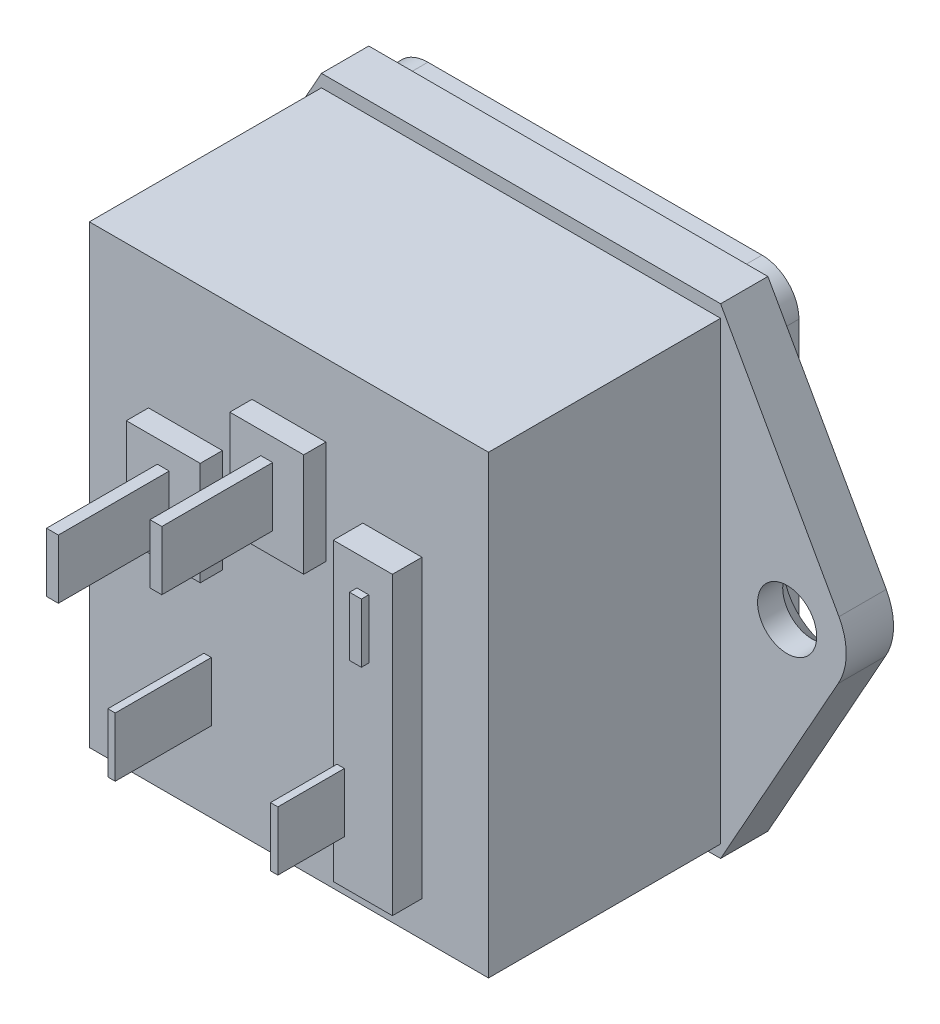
SolidWorks part; units mm, degrees
ref_plane "Front" through (0, 0, 0) normal (0, 0, 1) x (1, 0, 0)
ref_plane "Top" through (0, 0, 0) normal (0, 1, 0) x (1, 0, 0)
ref_plane "Right" through (0, 0, 0) normal (1, 0, 0) x (0, 0, -1)
sketch "Sketch1" plane through (0, 0, 0) normal (0, 0, 1) x (1, 0, 0)
  line L1 (-13.5, 15.4) -> (13.5, 15.4)
  line L2 (-13.5, 15.4) -> (-13.5, -15.4)
  line L3 (-13.5, -15.4) -> (13.5, -15.4)
  line L4 (13.5, 15.4) -> (13.5, -15.4)
extrude "Boss-Extrude1" add sketch "Sketch1" along normal blind 15.7
sketch "Sketch2" plane through (0, 0, 0) normal (0, 0, -1) x (-1, 0, 0)
  line L0 (13.5, 16.25) -> (-13.5, 16.25)
  line L1 (-13.5, -16.25) -> (13.5, -16.25)
  line L2 (-13.5, -16.25) -> (-21.4467, -2.0299)
  line L3 (-13.5, 16.25) -> (-21.5081, 1.9218)
  line L4 (13.5, 16.25) -> (21.5081, 1.9218)
  line L5 (13.5, -16.25) -> (21.5215, -1.8972)
  arc A0 (-21.5081, 1.9218) -> (-21.4467, -2.0299) centre (-18, 0) ccw
  arc A1 (21.5215, -1.8972) -> (21.5081, 1.9218) centre (18, 0) ccw
extrude "Boss-Extrude2" add sketch "Sketch2" along normal blind 3.2
sketch "Sketch3" plane through (0, 0, -3.2) normal (0, 0, -1) x (-1, 0, 0)
  line L0 (-13.8, -13) -> (-13.8, 13)
  line L1 (-11.3, 15.5) -> (11.3, 15.5)
  line L2 (13.8, 13) -> (13.8, -13)
  line L3 (11.3, -15.5) -> (-11.3, -15.5)
  arc A0 (13.8, 13) -> (11.3, 15.5) centre (11.3, 13) ccw
  arc A1 (-11.3, 15.5) -> (-13.8, 13) centre (-11.3, 13) ccw
  arc A2 (13.8, -13) -> (11.3, -15.5) centre (11.3, -13) cw
  arc A3 (-11.3, -15.5) -> (-13.8, -13) centre (-11.3, -13) cw
extrude "Boss-Extrude3" add sketch "Sketch3" along normal blind 1.8
sketch "Sketch4" plane through (0, 0, -3.2) normal (0, 0, -1) x (-1, 0, 0)
  circle A0 centre (-18.001, 0) radius 2
  circle A1 centre (18.001, 0) radius 2
extrude "Cut-Extrude1" cut sketch "Sketch4" against normal up to surface (3.2 mm away)
sketch "Sketch5" plane through (0, 0, -5) normal (0, 0, -1) x (-1, 0, 0)
  line L0 (-11, -2.1) -> (11, -2.1)
  line L1 (-7, 13.9) -> (7, 13.9)
  line L2 (12, -1.1) -> (12, 8.9)
  line L3 (-12, -1.1) -> (-12, 8.9)
  line L4 (12, 8.9) -> (7, 13.9)
  line L5 (-12, 8.9) -> (-7, 13.9)
  arc A0 (11, -2.1) -> (12, -1.1) centre (11, -1.1) ccw
  arc A1 (-11, -2.1) -> (-12, -1.1) centre (-11, -1.1) cw
extrude "Cut-Extrude2" cut sketch "Sketch5" against normal blind 19
sketch "Sketch6" plane through (0, 0, 14) normal (0, 0, -1) x (-1, 0, 0)
  line L1 (-1, 9) -> (1, 9)
  line L2 (-1, 9) -> (-1, 5)
  line L3 (-1, 5) -> (1, 5)
  line L4 (1, 9) -> (1, 5)
  line L5 (-8, 5) -> (-6, 5)
  line L6 (-8, 5) -> (-8, 1)
  line L7 (-8, 1) -> (-6, 1)
  line L8 (-6, 5) -> (-6, 1)
  line L9 (6, 1) -> (8, 1)
  line L10 (6, 1) -> (6, 5)
  line L11 (6, 5) -> (8, 5)
  line L12 (8, 1) -> (8, 5)
extrude "Boss-Extrude4" add sketch "Sketch6" along normal blind 17 separate body
sketch "Sketch7" plane through (0, 0, 15.7) normal (0, 0, 1) x (1, 0, 0)
  line L1 (-0.4, 9) -> (0.4, 9)
  line L2 (-0.4, 9) -> (-0.4, 5)
  line L3 (-0.4, 5) -> (0.4, 5)
  line L4 (0.4, 9) -> (0.4, 5)
  line L5 (-7.4, 5) -> (-6.6, 5)
  line L6 (-7.4, 5) -> (-7.4, 1)
  line L7 (-7.4, 1) -> (-6.6, 1)
  line L8 (-6.6, 5) -> (-6.6, 1)
extrude "Boss-Extrude5" add sketch "Sketch7" along normal blind 9 separate body
sketch "Sketch8" plane through (0, 0, 15.7) normal (0, 0, 1) x (1, 0, 0)
  line L1 (5, 7) -> (9, 7)
  line L2 (5, 7) -> (5, -13)
  line L3 (5, -13) -> (9, -13)
  line L4 (9, 7) -> (9, -13)
extrude "Boss-Extrude6" add sketch "Sketch8" along normal blind 2
sketch "Sketch9" plane through (0, 0, 17.7) normal (0, 0, 1) x (1, 0, 0)
  line L1 (6.6, 5) -> (7.4, 5)
  line L2 (6.6, 5) -> (6.6, 1)
  line L3 (6.6, 1) -> (7.4, 1)
  line L4 (7.4, 5) -> (7.4, 1)
extrude "Boss-Extrude7" add sketch "Sketch9" along normal blind 0.5
sketch "Sketch10" plane through (0, 0, 17.7) normal (0, 0, 1) x (1, 0, 0)
  line L1 (5.25, -6) -> (5.75, -6)
  line L2 (5.25, -6) -> (5.25, -10)
  line L3 (5.25, -10) -> (5.75, -10)
  line L4 (5.75, -6) -> (5.75, -10)
extrude "Boss-Extrude8" add sketch "Sketch10" along normal blind 4.5
sketch "Sketch11" plane through (0, 0, 15.7) normal (0, 0, 1) x (1, 0, 0)
  line L1 (-5.75, -6) -> (-5.25, -6)
  line L2 (-5.75, -6) -> (-5.75, -10)
  line L3 (-5.75, -10) -> (-5.25, -10)
  line L4 (-5.25, -6) -> (-5.25, -10)
extrude "Boss-Extrude9" add sketch "Sketch11" along normal blind 6.5 separate body
sketch "Sketch12" plane through (0, 0, 15.7) normal (0, 0, 1) x (1, 0, 0)
  line L1 (-2.5, 10.5) -> (2.5, 10.5)
  line L2 (-2.5, 10.5) -> (-2.5, 3.5)
  line L3 (-2.5, 3.5) -> (2.5, 3.5)
  line L4 (2.5, 10.5) -> (2.5, 3.5)
  line L5 (-9.5, 6.5) -> (-4.5, 6.5)
  line L6 (-9.5, 6.5) -> (-9.5, -0.5)
  line L7 (-9.5, -0.5) -> (-4.5, -0.5)
  line L8 (-4.5, 6.5) -> (-4.5, -0.5)
extrude "Boss-Extrude10" add sketch "Sketch12" along normal blind 1.5
sketch "Sketch14" plane through (0, 0, -5) normal (0, 0, -1) x (-1, 0, 0)
  line L0 (-4.3, -4.5) -> (-4.3, -2.1)
  line L1 (-12, -4.5) -> (-4.3, -4.5)
  line L2 (-12, -4.5) -> (-12, -12.9)
  line L3 (-12, -12.9) -> (12, -12.9)
  line L4 (12, -4.5) -> (12, -12.9)
  line L5 (-11, -2.1) -> (11, -2.1) construction
  line L6 (4.3, -4.5) -> (4.3, -2.1)
  line L7 (4.3, -4.5) -> (12, -4.5)
  line L8 (4.3, -2.1) -> (-4.3, -2.1)
extrude "Cut-Extrude-Thin1" cut sketch "Sketch14" against normal blind 0.01 thin
chamfer "Chamfer2" distance 1.5 angle 45 2 edges at (16.001, 0, -3.2) (-20.001, 0, -3.2)
